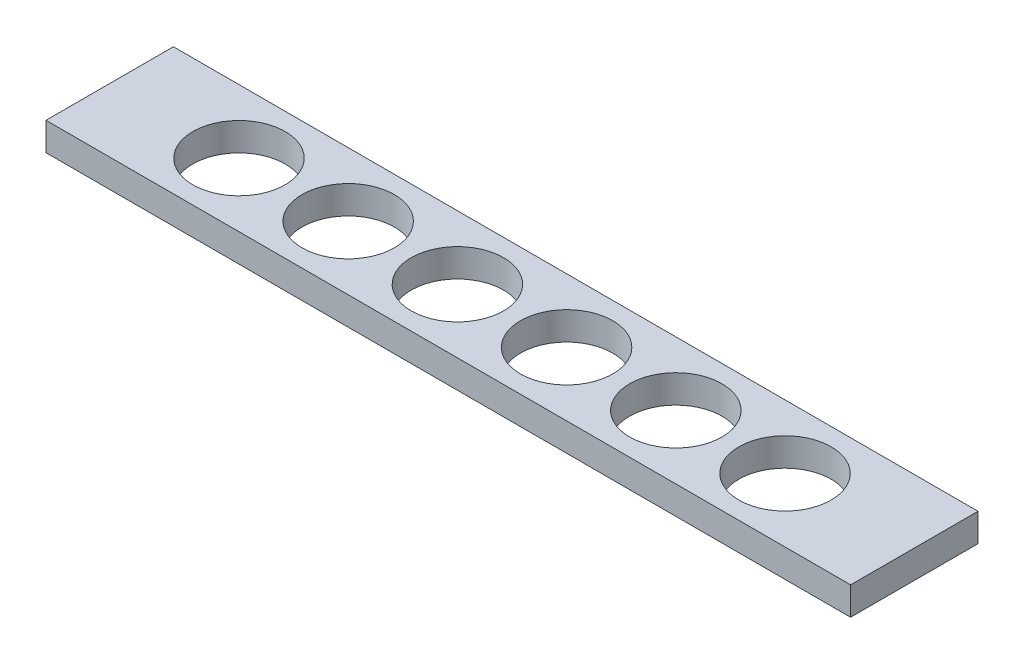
SolidWorks part; units mm, degrees
ref_plane "Front Plane" through (0, 0, 0) normal (0, 0, 1) x (1, 0, 0)
ref_plane "Top Plane" through (0, 0, 0) normal (0, 1, 0) x (1, 0, 0)
ref_plane "Right Plane" through (0, 0, 0) normal (1, 0, 0) x (0, 0, -1)
sketch "Sketch2" plane through (0, 0, 0) normal (0, 1, 0) x (1, 0, 0)
  line L0 (-67.5645, 5.9222) -> (122.9355, 5.9222) construction
  line L1 (-67.5645, 21.7972) -> (122.9355, 21.7972)
  line L2 (-67.5645, 21.7972) -> (-67.5645, -9.9528)
  line L3 (-67.5645, -9.9528) -> (122.9355, -9.9528)
  line L4 (122.9355, 21.7972) -> (122.9355, -9.9528)
  circle A0 centre (-40.3503, 5.9222) radius 11.5
  circle A1 centre (-13.1361, 5.9222) radius 11.5
  circle A2 centre (14.0781, 5.9222) radius 11.5
  circle A3 centre (41.2929, 5.9222) radius 11.5
  circle A4 centre (68.5071, 5.9222) radius 11.5
  circle A5 centre (95.7213, 5.9222) radius 11.5
  dimension "D3" = 23
  dimension "D4" = 23
  dimension "D5" = 23
  dimension "D6" = 23
  dimension "D7" = 23
  dimension "D8" = 23
  dimension "D1" = 31.75
  dimension "D2" = 190.5
extrude "Extrude1" add sketch "Sketch2" along normal blind 7
sketch "Sketch3" plane through (0, 0, 0) normal (0, 1, 0) x (1, 0, 0)
  line L1 (-67.5645, 21.7972) -> (-72.5645, 21.7972)
  line L2 (-67.5645, 21.7972) -> (-67.5645, -9.9528)
  line L3 (-67.5645, -9.9528) -> (-72.5645, -9.9528)
  line L4 (-72.5645, 21.7972) -> (-72.5645, -9.9528)
  line L5 (122.9355, 21.7972) -> (127.9355, 21.7972)
  line L6 (122.9355, 21.7972) -> (122.9355, -9.9528)
  line L7 (122.9355, -9.9528) -> (127.9355, -9.9528)
  line L8 (127.9355, 21.7972) -> (127.9355, -9.9528)
  dimension "D1" = 5
  dimension "D2" = 5
extrude "Extrude2" add sketch "Sketch3" along normal blind 7
